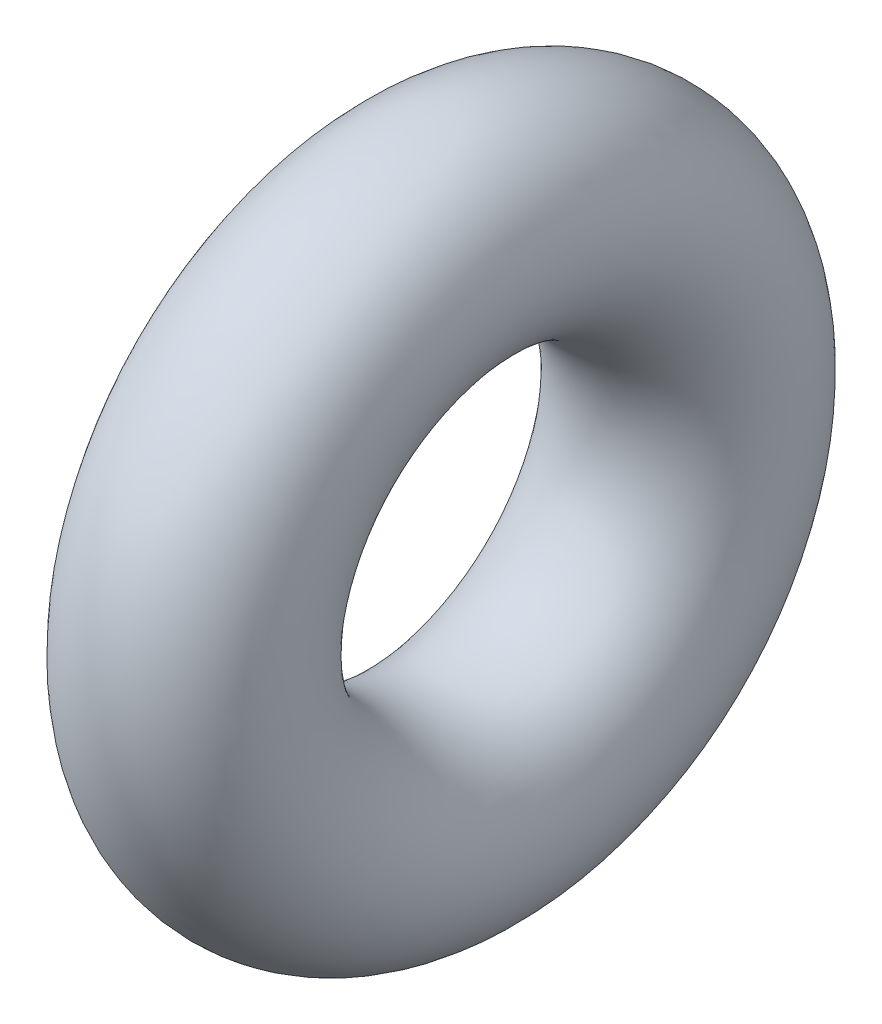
SolidWorks part; units mm, degrees
ref_plane "Face" through (0, 0, 0) normal (0, 0, 1) x (1, 0, 0)
ref_plane "Dessus" through (0, 0, 0) normal (0, 1, 0) x (1, 0, 0)
ref_plane "Droite" through (0, 0, 0) normal (1, 0, 0) x (0, 0, -1)
sketch "Esquisse1" plane through (0, 0, 0) normal (0, 0, 1) x (1, 0, 0)
  line L0 (0.4, 5.5449) -> (11.9046, 5.5449) construction
  circle A0 centre (7.1, 7.4449) radius 0.8
  dimension "D1" = 1.6
  dimension "D2" = 2.2
revolve "Révolution1" add sketch "Esquisse1" angle 360 about L0
